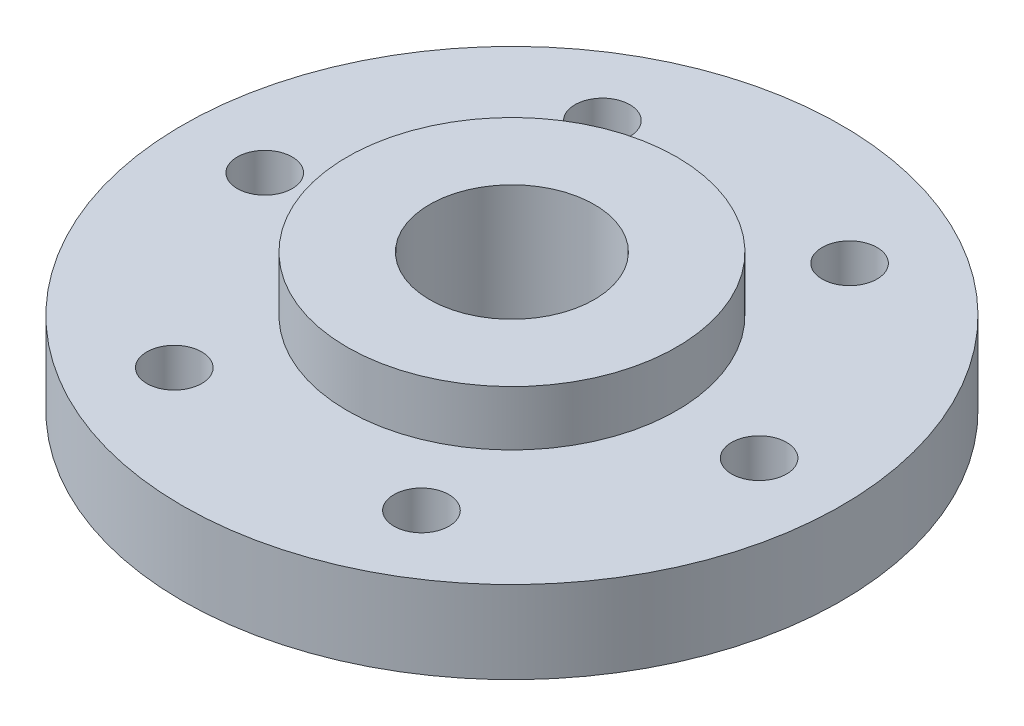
SolidWorks part; units mm, degrees
ref_plane "前视基准面" through (0, 0, 0) normal (0, 0, 1) x (1, 0, 0)
ref_plane "上视基准面" through (0, 0, 0) normal (0, 1, 0) x (1, 0, 0)
ref_plane "右视基准面" through (0, 0, 0) normal (1, 0, 0) x (0, 0, -1)
other "Configuration Table"
sketch "草图1" plane through (0, 0, 0) normal (0, 1, 0) x (1, 0, 0)
  circle A0 centre (0, 0) radius 60
extrude "凸台-拉伸1" add sketch "草图1" along normal blind 15
sketch "草图2" plane through (0, 15, 0) normal (0, 1, 0) x (1, 0, 0)
  circle A0 centre (0, 0) radius 30
extrude "凸台-拉伸2" add sketch "草图2" along normal blind 10
sketch "草图3" plane through (0, 0, 0) normal (0, 1, 0) x (1, 0, 0)
  circle A0 centre (0, 0) radius 15
extrude "切除-拉伸1" cut sketch "草图3" along normal blind 30
sketch "草图4" plane through (0, 0, 0) normal (0, 1, 0) x (1, 0, 0)
  circle A0 centre (45, 0) radius 5
  circle A1 centre (22.5, 38.9711) radius 5
  circle A2 centre (-22.5, 38.9711) radius 5
  circle A3 centre (-45, 0) radius 5
  circle A4 centre (-22.5, -38.9711) radius 5
  circle A5 centre (22.5, -38.9711) radius 5
extrude "切除-拉伸2" cut sketch "草图4" along normal blind 20
